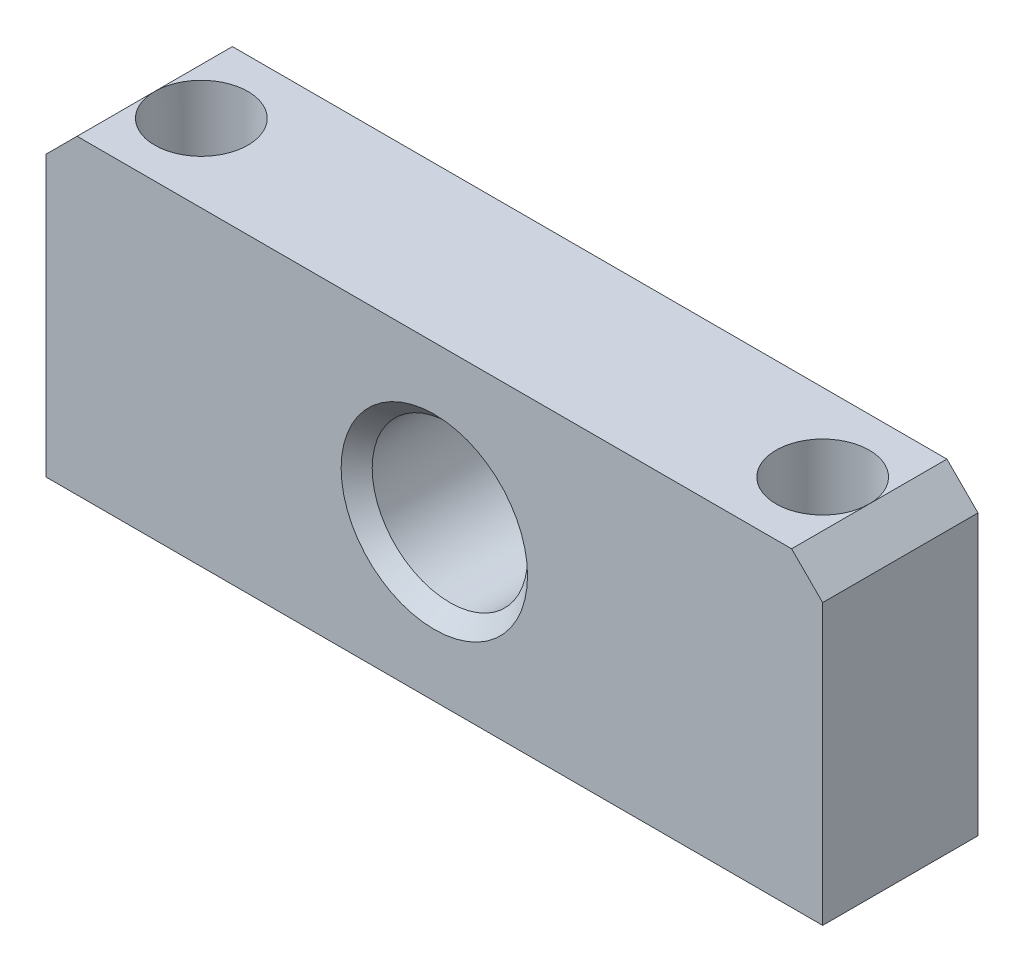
SolidWorks part; units mm, degrees
ref_plane "Face" through (0, 0, 0) normal (0, 0, 1) x (1, 0, 0)
ref_plane "Dessus" through (0, 0, 0) normal (0, 1, 0) x (1, 0, 0)
ref_plane "Droite" through (0, 0, 0) normal (1, 0, 0) x (0, 0, -1)
sketch "Esquisse1" plane through (0, 0, 0) normal (0, 0, 1) x (1, 0, 0)
  line L1 (0, 0) -> (50, 0)
  line L2 (0, 0) -> (0, 20)
  line L3 (0, 20) -> (50, 20)
  line L4 (50, 0) -> (50, 20)
  dimension "D1" = 50
  dimension "D2" = 20
extrude "Base-Extrusion" add sketch "Esquisse1" along normal blind 10
sketch "Esquisse2" plane through (0, 20, 0) normal (0, 1, 0) x (-1, 0, 0)
  line L0 (-50, 0) -> (-45, 0) construction
  line L1 (-50, 0) -> (0, 0) construction
  line L2 (-45, 0) -> (-45, 10) construction
  line L3 (-50, 10) -> (0, 10) construction
  line L4 (0, 0) -> (-5, 0) construction
  line L5 (-5, 0) -> (-5, 10) construction
  circle A0 centre (-45, 5) radius 3
  circle A1 centre (-5, 5) radius 3
  dimension "D2" = 6
  dimension "D1" = 40
extrude "Enlèv. mat.-Extru.1" cut sketch "Esquisse2" against normal blind 10
sketch "Esquisse3" plane through (0, 10, 0) normal (0, 1, 0) x (-1, 0, 0)
  circle A0 centre (-45, 5) radius 1.5
  circle A1 centre (-5, 5) radius 1.5
  circle A2 centre (-45, 5) radius 3 construction
  circle A3 centre (-5, 5) radius 3 construction
  dimension "D1" = 3
extrude "Enlèv. mat.-Extru.2" cut sketch "Esquisse3" against normal through all
chamfer "Chanfrein1" distance 2 angle 45
sketch "Esquisse4" plane through (0, 0, 10) normal (0, 0, 1) x (1, 0, 0)
  line L0 (25, 0) -> (25, 20) construction
  line L1 (0, 0) -> (50, 0) construction
  circle A0 centre (25, 10) radius 5
  dimension "D1" = 10
  dimension "D2" = 10
extrude "Enlèv. mat.-Extru.3" cut sketch "Esquisse4" against normal through all
chamfer "Chanfrein2" distance 1 angle 45
